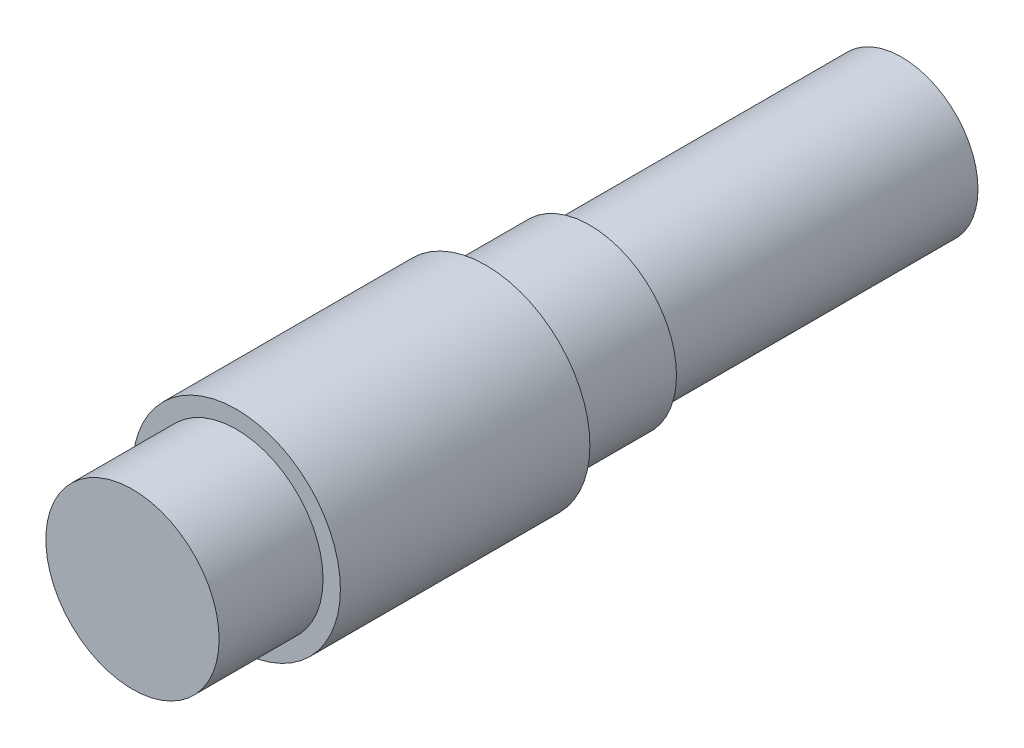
SolidWorks part; units mm, degrees
ref_plane "Front Plane" through (0, 0, 0) normal (0, 0, 1) x (1, 0, 0)
ref_plane "Top Plane" through (0, 0, 0) normal (0, 1, 0) x (1, 0, 0)
ref_plane "Right Plane" through (0, 0, 0) normal (1, 0, 0) x (0, 0, -1)
sketch "Skizze1" plane through (0, 0, 0) normal (0, 0, 1) x (1, 0, 0)
  circle A0 centre (0, 0) radius 15
  dimension "D1" = 30
extrude "Aufsatz-Linear austragen1" add sketch "Skizze1" along normal mid plane 36
sketch "Skizze2" plane through (0, 0, 0) normal (0, 0, 1) x (1, 0, 0)
  circle A0 centre (0, 0) radius 12.5
  dimension "D1" = 25
extrude "Aufsatz-Linear austragen2" add sketch "Skizze2" along normal mid plane 66
sketch "Skizze3" plane through (0, 0, 0) normal (0, 0, 1) x (1, 0, 0)
  circle A0 centre (0, 0) radius 11
  dimension "D1" = 22
extrude "Aufsatz-Linear austragen3" add sketch "Skizze3" against normal blind 78
